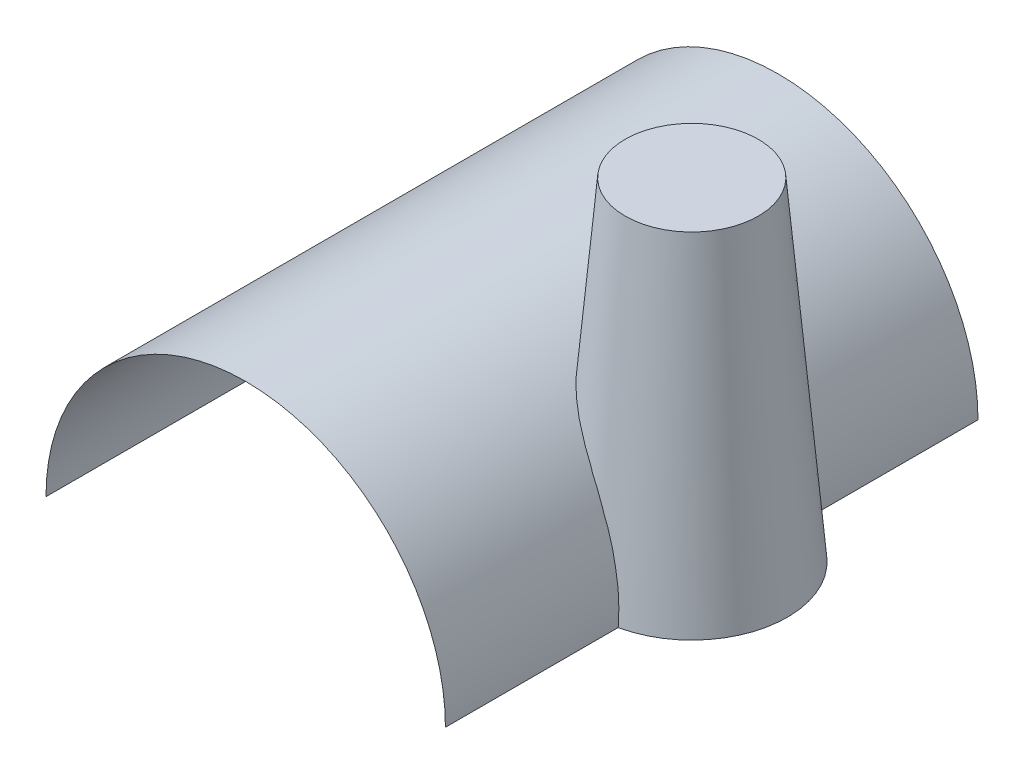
SolidWorks part; units mm, degrees
ref_plane "Front Plane" through (0, 0, 0) normal (0, 0, 1) x (1, 0, 0)
ref_plane "Top Plane" through (0, 0, 0) normal (0, 1, 0) x (1, 0, 0)
ref_plane "Right Plane" through (0, 0, 0) normal (1, 0, 0) x (0, 0, -1)
sketch "Sketch1" plane through (0, 0, 0) normal (0, 0, 1) x (1, 0, 0)
  line L0 (-19.05, 0) -> (19.05, 0) construction
  arc A0 (19.05, 0) -> (-19.05, 0) centre (0, 0) ccw
  dimension "D1" = 38.1
ref_plane "Plane1" through (0, 31.75, 0) normal (0, 1, 0) x (-1, 0, 0)
sketch "Sketch2" plane through (0, 31.75, 0) normal (0, 1, 0) x (-1, 0, 0)
  line L2 (19.05, 0) -> (-19.05, 0) construction
  line L3 (0, 17.4625) -> (0, -17.4625) construction
  circle A0 centre (-17.145, -25.4) radius 6.35
  dimension "D3" = 12.7
  dimension "D2" = 17.145
  dimension "D1" = 25.4
surface "Surface-Extrude1" sketch "Sketch1" parameters "D1"=50.8
surface "Surface-Extrude2" sketch "Sketch2" parameters "D3"=5
surface "Surface-Plane1"
